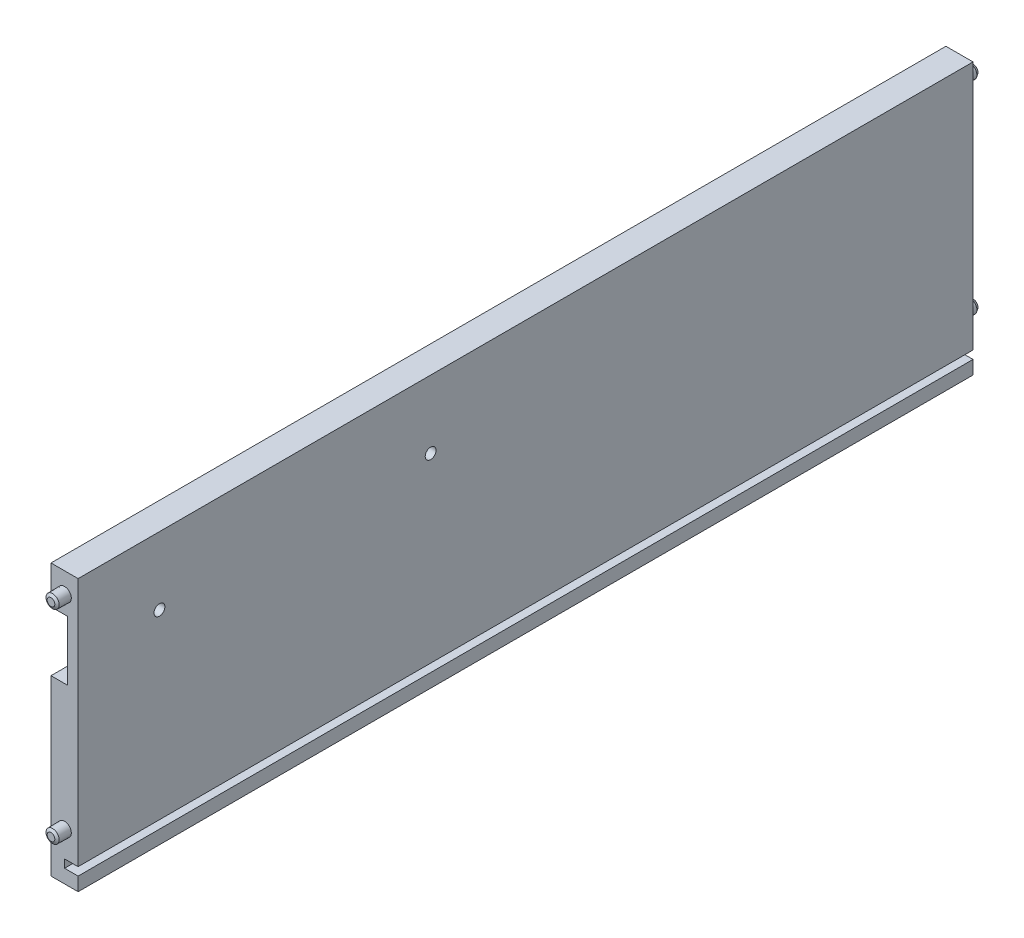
SolidWorks part; units mm, degrees
ref_plane "Front Plane" through (0, 0, 0) normal (0, 0, 1) x (1, 0, 0)
ref_plane "Top Plane" through (0, 0, 0) normal (0, 1, 0) x (1, 0, 0)
ref_plane "Right Plane" through (0, 0, 0) normal (1, 0, 0) x (0, 0, -1)
sketch "Sketch1" plane through (0, 0, 0) normal (1, 0, 0) x (0, 0, -1)
  line L1 (-165, -50) -> (165, -50)
  line L2 (-165, -50) -> (-165, 50)
  line L3 (-165, 50) -> (165, 50)
  line L4 (165, -50) -> (165, 50)
  line L5 (-165, -50) -> (165, 50) construction
  line L6 (-165, 50) -> (165, -50) construction
  point P0 (0, 0)
  dimension "D1" = 100
  dimension "D2" = 330
extrude "Boss-Extrude1" add sketch "Sketch1" along normal blind 10
sketch "Sketch2" plane through (0, 0, 0) normal (-1, 0, 0) x (0, 0, 1)
  line L0 (165, 50) -> (165, -50) construction
  line L1 (-165, 36) -> (165, 36)
  line L2 (-165, 36) -> (-165, 14)
  line L3 (-165, 14) -> (165, 14)
  line L4 (165, 36) -> (165, 14)
  line L5 (-165, 36) -> (165, 14) construction
  line L6 (-165, 14) -> (165, 36) construction
  line L7 (0, 0) -> (0, 25) construction
  point P0 (0, 25)
  dimension "D1" = 22
  dimension "D2" = 25
extrude "Cut-Extrude1" cut sketch "Sketch2" against normal blind 6
sketch "Sketch3" plane through (6, 0, 0) normal (-1, 0, 0) x (0, 0, 1)
  line L0 (-165, 25) -> (75.9783, 25) construction
  line L1 (-165, 36) -> (-165, 14) construction
  line L3 (85, 25) -> (85, 20.6277) construction
  line L4 (-165, 36) -> (-165, 50) construction
  circle A0 centre (35, 25) radius 2
  circle A1 centre (135, 25) radius 2
  dimension "D2" = 4
  dimension "D1" = 100
  dimension "D3" = 200
extrude "Cut-Extrude2" cut sketch "Sketch3" against normal blind 10
sketch "Sketch4" plane through (0, 0, -165) normal (0, 0, -1) x (-1, 0, 0)
  line L0 (-5, 50) -> (-5, 42.5) construction
  line L1 (-10, 50) -> (0, 50) construction
  line L2 (-5, 42.5) -> (-5, 5) construction
  line L3 (-5, 5) -> (0, 5) construction
  line L4 (-10, -50) -> (0, -50) construction
  circle A0 centre (-5, 42.5) radius 2.5
  circle A1 centre (-5, -32.5) radius 2.5
  point P10 (-5, -50)
  dimension "D1" = 5
  dimension "D2" = 75
  dimension "D3" = 17.5
extrude "Boss-Extrude2" add sketch "Sketch4" along normal blind 5 draft 1
mirror "Mirror1" about plane through (0, 0, 0) normal (0, 0, 1) of "Boss-Extrude2"
chamfer "Chamfer1" distance 1 angle 30 4 edges at (2.5873, 42.5, -170) (7.4127, -32.5, -170) (7.4127, 42.5, 170) (2.5873, -32.5, 170)
sketch "Sketch5" plane through (10, 0, 0) normal (1, 0, 0) x (0, 0, -1)
  line L0 (-165, 50) -> (-165, -50) construction
  line L1 (-165, -42) -> (165, -42)
  line L2 (-165, -42) -> (-165, -45)
  line L3 (-165, -45) -> (165, -45)
  line L4 (165, -42) -> (165, -45)
  line L5 (165, -50) -> (165, 50) construction
  line L6 (-165, -50) -> (165, -50) construction
  dimension "D1" = 3
  dimension "D2" = 5
extrude "Cut-Extrude3" cut sketch "Sketch5" against normal blind 5
